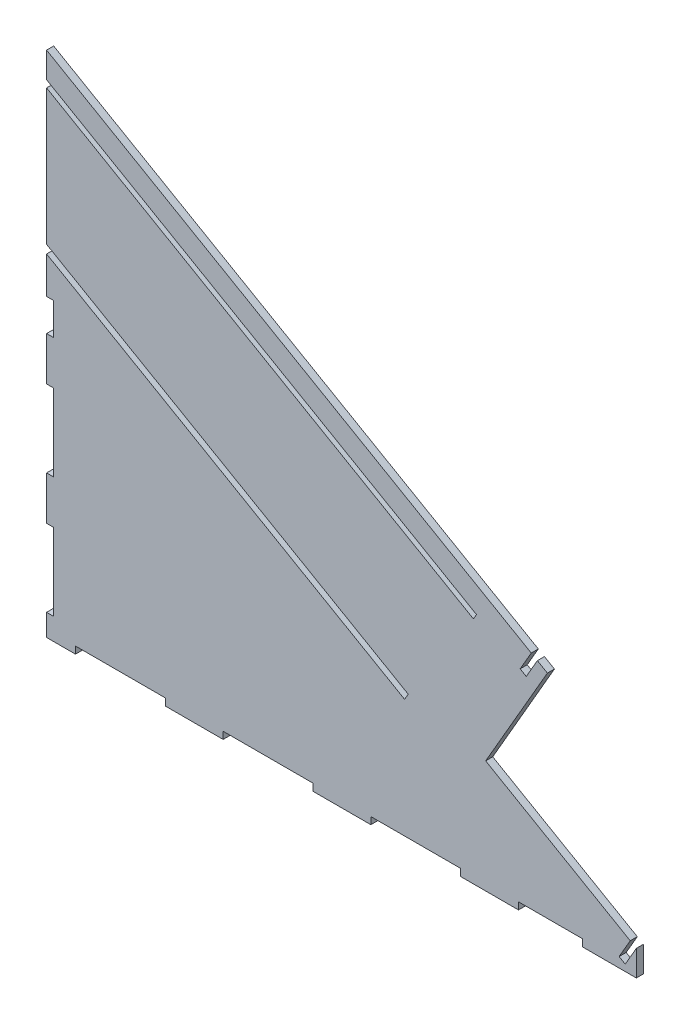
SolidWorks part; units mm, degrees
ref_plane "Front Plane" through (0, 0, 0) normal (0, 0, 1) x (1, 0, 0)
ref_plane "Top Plane" through (0, 0, 0) normal (0, 1, 0) x (1, 0, 0)
ref_plane "Right Plane" through (0, 0, 0) normal (1, 0, 0) x (0, 0, -1)
sketch "Sketch1" plane through (0, 0, 0) normal (0, 0, 1) x (1, 0, 0)
  line L6 (0, 336) -> (390, 110.8299) construction
  line L7 (0, 336) -> (0, 447) construction
  line L8 (0, 447) -> (390, 221.8299) construction
  line L9 (390, 221.8299) -> (390, 110.8299) construction
  line L14 (0, 447) -> (0, 467)
  line L15 (390, 110.8299) -> (459.2818, 70.8294) construction
  line L16 (459.2818, 70.8294) -> (0, 70.8294) construction
  line L21 (459.2818, 70.8294) -> (459.2818, 90.8294)
  line L23 (390, 130.8299) -> (454.5186, 93.5794)
  line L26 (459.2818, 90.8294) -> (450.6214, 75.8295)
  line L27 (450.6214, 75.8295) -> (445.8583, 78.5796)
  line L28 (445.8583, 78.5796) -> (454.5186, 93.5794)
  line L29 (0, 70.8294) -> (57.5, 70.8294) construction
  line L35 (92.5, 70.8294) -> (137.5, 70.8294)
  line L36 (92.5, 70.8294) -> (92.5, 76.3294)
  line L37 (92.5, 76.3294) -> (22.5, 76.3294)
  line L38 (22.5, 76.3294) -> (22.5, 70.8294)
  line L39 (92.5, 76.3294) -> (137.5, 76.3294) construction
  line L40 (137.5, 76.3294) -> (207.5, 76.3294)
  line L41 (207.5, 76.3294) -> (207.5, 70.8294)
  line L42 (137.5, 76.3294) -> (137.5, 70.8294)
  line L43 (207.5, 76.3294) -> (252.5, 76.3294) construction
  line L44 (252.5, 76.3294) -> (322.5, 76.3294)
  line L45 (322.5, 76.3294) -> (322.5, 70.8294)
  line L46 (252.5, 76.3294) -> (252.5, 70.8294)
  line L47 (322.5, 76.3294) -> (367.5, 76.3294) construction
  line L50 (367.5, 76.3294) -> (367.5, 70.8294)
  line L51 (0, 70.8294) -> (22.5, 70.8294)
  line L52 (207.5, 70.8294) -> (252.5, 70.8294)
  line L53 (322.5, 70.8294) -> (367.5, 70.8294)
  line L54 (437.5, 70.8294) -> (459.2818, 70.8294)
  line L55 (0, 70.8294) -> (5.5, 70.8294) construction
  line L56 (5.5, 70.8294) -> (5.5, 87.8294) construction
  line L57 (5.5, 87.8294) -> (0, 87.8294)
  line L58 (5.5, 87.8294) -> (5.5, 147.8294)
  line L59 (5.5, 147.8294) -> (0, 147.8294)
  line L60 (5.5, 147.8294) -> (5.5, 181.8294) construction
  line L61 (5.5, 181.8294) -> (0, 181.8294)
  line L62 (5.5, 181.8294) -> (5.5, 241.8294)
  line L63 (5.5, 241.8294) -> (0, 241.8294)
  line L64 (5.5, 241.8294) -> (5.5, 275.8294) construction
  line L65 (5.5, 275.8294) -> (0, 275.8294)
  line L66 (5.5, 275.8294) -> (5.5, 300.8294)
  line L67 (5.5, 300.8294) -> (0, 300.8294)
  line L68 (0, 336) -> (0, 391.5) construction
  line L69 (0, 391.5) -> (0, 421.5) construction
  line L74 (0, 361.5) -> (0, 336)
  line L75 (0, 329.5) -> (0, 300.8294)
  line L76 (0, 275.8294) -> (0, 241.8294)
  line L77 (0, 181.8294) -> (0, 147.8294)
  line L78 (0, 70.8294) -> (0, 87.8294)
  line L79 (0, 447) -> (332.4134, 255.0781)
  line L81 (332.4134, 249.5781) -> (0, 441.5)
  line L82 (0, 421.5) -> (0, 441.5)
  line L83 (382.2058, 246.3299) -> (373.5455, 231.3301) construction
  line L84 (373.5455, 231.3301) -> (368.7823, 234.0801) construction
  line L85 (368.7823, 234.0801) -> (377.4427, 249.08) construction
  line L86 (377.4427, 249.08) -> (368.7823, 234.0801)
  line L87 (368.7823, 234.0801) -> (373.5455, 231.3301)
  line L88 (373.5455, 231.3301) -> (382.2058, 246.3299)
  line L89 (0, 467) -> (377.4427, 249.08)
  line L90 (382.2058, 246.3299) -> (390, 241.8299)
  line L94 (0, 336) -> (276.7437, 176.2194)
  line L95 (0, 329.5) -> (278.8041, 168.5299)
  line L96 (454.5186, 93.5794) -> (390, 130.8299) construction
  line L97 (0, 421.5) -> (0, 361.5)
  line L98 (390, 241.8299) -> (341.9352, 158.5805) construction
  line L99 (390, 241.8299) -> (341.9352, 158.5805)
  line L100 (341.9352, 158.5805) -> (390, 130.8299)
  line L105 (-14.26, 70.8294) -> (-14.26, 76.3294) construction
  line L106 (278.8041, 168.5299) -> (281.6187, 173.4048)
  line L137 (281.6187, 173.4048) -> (276.7437, 176.2194)
  line L138 (332.4134, 249.5781) -> (334.795, 253.703)
  line L139 (334.795, 253.703) -> (332.4134, 255.0781)
  line L140 (367.5, 76.3294) -> (417.5, 76.3294)
  line L141 (417.5, 76.3294) -> (417.5, 70.8294)
  line L142 (417.5, 70.8294) -> (437.5, 70.8294)
  point P20 (0, 70.8294)
  dimension "D1" = 376.1706
  dimension "D2" = 459.2818
  dimension "D3" = 386.5894
  dimension "D4" = 53.7454
extrude "Boss-Extrude1" add sketch "Sketch1" along normal blind 5.5
